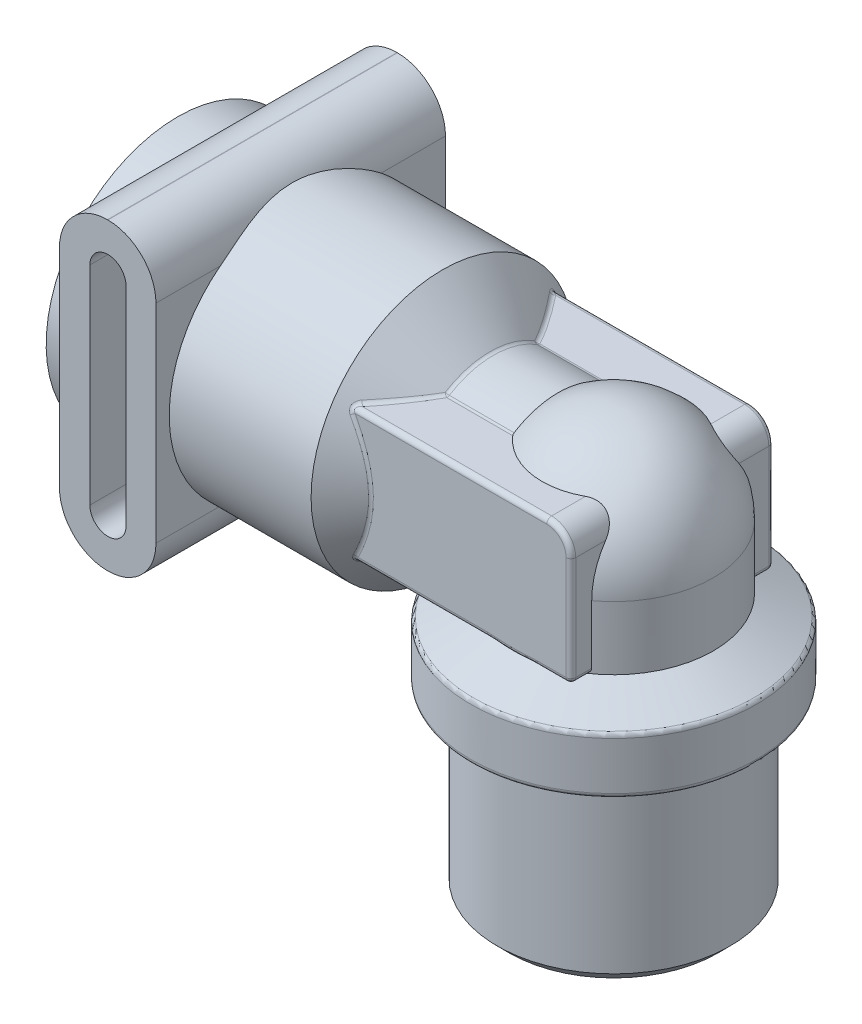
SolidWorks part; units mm, degrees
ref_plane "Plan de face" through (0, 0, 0) normal (0, 0, 1) x (1, 0, 0)
ref_plane "Plan de dessus" through (0, 0, 0) normal (0, 1, 0) x (1, 0, 0)
ref_plane "Plan de droite" through (0, 0, 0) normal (1, 0, 0) x (0, 0, -1)
sketch "Esquisse1" plane through (0, 0, 0) normal (0, 0, 1) x (1, 0, 0)
  line L0 (0, 0) -> (0, 41.9978) construction
  line L1 (1.675, 0) -> (1.675, 14.02)
  line L2 (1.675, 0) -> (1.875, 0)
  line L3 (1.875, 0) -> (2.225, 0.65)
  line L4 (2.225, 0.65) -> (4.325, 0.65)
  line L5 (4.325, 0.65) -> (4.825, 1.15)
  line L6 (4.825, 1.15) -> (4.825, 8.2)
  line L7 (4.825, 8.2) -> (5.925, 8.2)
  line L8 (5.925, 8.2) -> (5.925, 10.5)
  line L9 (5.925, 10.5) -> (4.13, 11.395)
  line L10 (4.13, 11.395) -> (4.13, 14.02)
  line L11 (0, 18.15) -> (0, 15.695)
  arc A0 (4.13, 14.02) -> (0, 18.15) centre (0, 14.02) ccw
  arc A1 (1.675, 14.02) -> (0, 15.695) centre (0, 14.02) ccw
  point P9 (4.825, 0.65)
  point P16 (0, 18.15)
  dimension "D12" = 8.26
  dimension "D1" = 3.35
  dimension "D2" = 4.45
  dimension "D3" = 0.2
  dimension "D4" = 0.65
  dimension "D5" = 9.65
  dimension "D6" = 7.55
  dimension "D7" = 11.85
  dimension "D8" = 0.5
  dimension "D9" = 2.3
  dimension "D10" = 116.5
  dimension "D11" = 17.5
revolve "Révolution1" add sketch "Esquisse1" angle 360 about L0
sketch "Esquisse2" plane through (0, 0, 0) normal (0, 0, 1) x (1, 0, 0)
  line L0 (2.3004, 17.45) -> (-5.07, 17.45)
  line L1 (-5.07, 17.45) -> (-7.09, 19.47)
  line L2 (-7.09, 19.47) -> (-18.07, 19.47)
  line L3 (-18.07, 19.47) -> (-18.07, 17.52)
  line L4 (-18.07, 17.52) -> (-14.07, 17.52)
  line L5 (0, 16.82) -> (2.3004, 17.45)
  line L6 (0, 14.02) -> (-21.8375, 14.02) construction
  line L7 (4.13, 14.02) -> (-4.13, 14.02) construction
  line L8 (-14.07, 17.52) -> (-14.07, 14.02)
  line L9 (-4.325, 0.65) -> (4.325, 0.65) construction
  line L10 (-14.07, 14.02) -> (0, 14.02)
  line L11 (0, 14.02) -> (0, 16.82)
  arc A0 (4.13, 14.02) -> (-4.13, 14.02) centre (0, 14.02) ccw construction
  point P8 (4.13, 14.02)
  dimension "D1" = 7
  dimension "D2" = 10.9
  dimension "D3" = 13
  dimension "D4" = 22.2
  dimension "D5" = 135
  dimension "D6" = 16.8
  dimension "D7" = 0.63
  dimension "D8" = 4
revolve "Révolution2" add sketch "Esquisse2" angle 360 about L6
sketch "Esquisse3" plane through (0, 0, 0) normal (0, 0, 1) x (1, 0, 0)
  line L0 (-18.07, 19.47) -> (-18.07, 8.57) construction
  line L1 (-14.98, 20.32) -> (-14.96, 20.32)
  line L2 (-16.97, 18.33) -> (-16.97, 9.71)
  line L3 (-14.98, 7.72) -> (-14.96, 7.72)
  line L4 (-12.97, 18.33) -> (-12.97, 9.71)
  line L5 (-18.07, 14.02) -> (-14.0558, 14.02) construction
  line L7 (-18.07, 8.57) -> (-7.09, 8.57) construction
  arc A0 (-14.96, 20.32) -> (-12.97, 18.33) centre (-14.96, 18.33) cw
  arc A1 (-14.98, 20.32) -> (-16.97, 18.33) centre (-14.98, 18.33) ccw
  arc A2 (-16.97, 9.71) -> (-14.98, 7.72) centre (-14.98, 9.71) ccw
  arc A3 (-14.96, 7.72) -> (-12.97, 9.71) centre (-14.96, 9.71) ccw
  point P11 (-16.97, 20.32)
  point P14 (-16.97, 7.72)
  dimension "D5" = 1.99
  dimension "D1" = 4
  dimension "D2" = 12.6
  dimension "D3" = 0.85
  dimension "D4" = 1.1
extrude "Extrusion1" add sketch "Esquisse3" along normal mid plane 12
sketch "Esquisse8" plane through (0, 0, 0) normal (0, 0, 1) x (1, 0, 0)
  line L0 (-3.07, 16.77) -> (-3.07, 15.67)
  line L2 (-6.92, 16.77) -> (-3.07, 16.77)
  line L4 (-19.3371, 14.02) -> (1.675, 14.02) construction
  line L9 (0, 14.02) -> (-21.8327, 14.02)
  line L10 (-21.8327, 14.02) -> (-21.8327, 17.52)
  line L14 (-18.07, 19.47) -> (-18.07, 8.57) construction
  line L16 (-21.8327, 17.52) -> (-6.92, 17.52)
  line L17 (-6.92, 17.52) -> (-6.92, 16.77)
  line L20 (-3.07, 15.67) -> (0, 15.67)
  line L21 (0, 14.02) -> (0, 15.695) construction
  line L22 (0, 15.67) -> (0, 14.02)
  dimension "D3" = 3.5
  dimension "D1" = 1.65
  dimension "D2" = 11.15
  dimension "D4" = 2.75
  dimension "D5" = 15
revolve "Enlèvement de matière-Révolution1" cut sketch "Esquisse8" angle 360 about L9
sketch "Esquisse9" plane through (0, 0, 6) normal (0, 0, 1) x (1, 0, 0)
  line L0 (-14.21, 18.33) -> (-14.21, 9.71)
  line L1 (-15.71, 18.33) -> (-15.71, 9.71)
  arc A0 (-14.21, 18.33) -> (-15.71, 18.33) centre (-14.96, 18.33) ccw
  arc A1 (-15.71, 9.71) -> (-14.21, 9.71) centre (-14.96, 9.71) ccw
  dimension "D1" = 1.5
  dimension "D2" = 1.5
extrude "Enlèv. mat.-Extru.5" cut sketch "Esquisse9" against normal through all
ref_plane "Plan1" through (0, 0, 4.2) normal (0, 0, 1) x (1, 0, 0)
sketch "Esquisse10" plane through (0, 0, 4.2) normal (0, 0, 1) x (1, 0, 0)
  line L0 (-5.07, 10.8448) -> (-5.07, 17.45) construction
  line L1 (-7.07, 16.8943) -> (2.43, 16.8943)
  line L2 (-7.07, 16.8943) -> (-7.07, 11.3943)
  line L3 (-7.07, 11.3943) -> (2.43, 11.3943)
  line L4 (2.43, 16.8943) -> (2.43, 11.3943)
  dimension "D1" = 5.5
  dimension "D2" = 7.5
  dimension "D3" = 9.5
extrude "Extrusion2" add sketch "Esquisse10" against normal up to body separate body
fillet "Congé2" radius 1 1 edges at (2.43, 16.8943, 2.9501)
fillet "Congé3" radius 0.2 1 edges at (-3.6852, 16.8943, 1.8717)
mirror "Symétrie1" about plane through (0, 0, 0) normal (0, 0, 1) of "Congé2", "Extrusion2", "Congé3"
fillet "Congé10" radius 0.2 1 edges at (0, 8.2, -4.825)
fillet "Congé11" radius 0.2 1 edges at (0, 8.2, -5.925)
fillet "Congé12" radius 0.2 1 edges at (5.925, 10.5, 0)
sketch "Esquisse12" plane through (0, 0, 0) normal (0, 0, 1) x (1, 0, 0)
  line L1 (1.675, 14.02) -> (0, 14.02)
  line L2 (1.675, 14.02) -> (1.675, 9.8724)
  line L3 (1.675, 9.8724) -> (0, 9.8724)
  line L4 (0, 14.02) -> (0, 9.8724)
revolve "Enlèvement de matière-Révolution2" cut sketch "Esquisse12" angle 360 about L4
fillet "Congé21" radius 0.2 6 edges at (2.43, 13.6443, -4.2) (2.1371, 16.6014, -4.2) (2.43, 13.6443, 4.2) (2.1371, 16.6014, 4.2) (-2.6497, 16.8943, -4.2) (-2.6497, 16.8943, 4.2)
fillet "Congé22" radius 0.2 3 edges at (-2.1816, 11.3943, 4.2) (2.3714, 11.3943, 4.1414)
fillet "Congé23" radius 0.2 11 edges at (-6.5179, 11.4836, 4.1666) (-5.8416, 13.9026, -4.2) (-6.6506, 16.8224, -4.1536) (-5.0774, 16.903, -1.8718) (-5.07, 17.45, 0) (-5.0803, 16.9004, 1.8813) (-6.6474, 16.8378, 4.1393) (-5.8416, 13.9026, 4.2)
fillet "Congé24" radius 0.2 4 edges at (-6.6037, 11.3943, -4.2323) (2.3714, 11.3943, -4.1414) (-2.1255, 11.3943, -4.2)
fillet "Congé25" radius 0.2 2 edges at (-6.5045, 11.4153, -4.1084)
